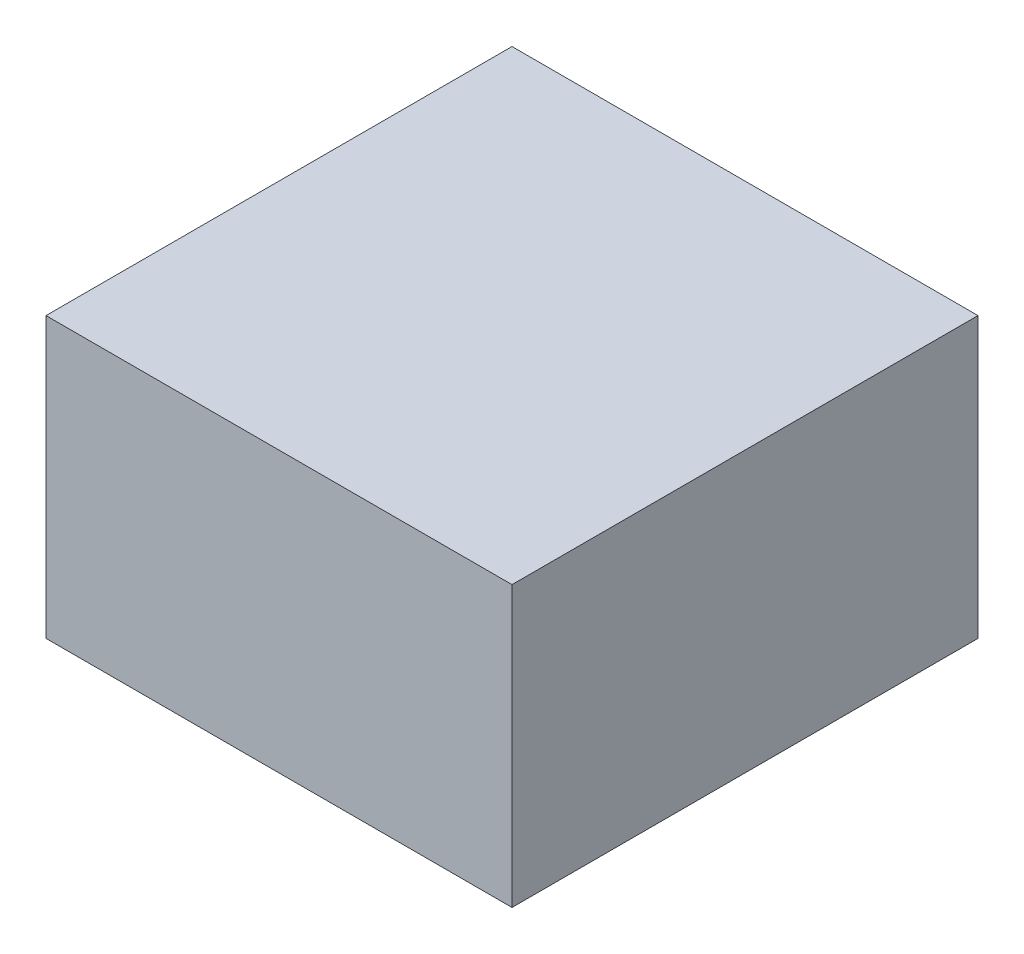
SolidWorks part; units mm, degrees
ref_plane "Plan de face" through (0, 0, 0) normal (0, 0, 1) x (1, 0, 0)
ref_plane "Plan de dessus" through (0, 0, 0) normal (0, 1, 0) x (1, 0, 0)
ref_plane "Plan de droite" through (0, 0, 0) normal (1, 0, 0) x (0, 0, -1)
sketch "Esquisse1" plane through (0, 0, 0) normal (0, 0, 1) x (1, 0, 0)
  line L1 (0, 0) -> (60, 0)
  line L2 (0, 0) -> (0, 36)
  line L3 (0, 36) -> (60, 36)
  line L4 (60, 0) -> (60, 36)
  dimension "D1" = 36
  dimension "D2" = 60
extrude "Extrusion1" add sketch "Esquisse1" along normal mid plane 60
